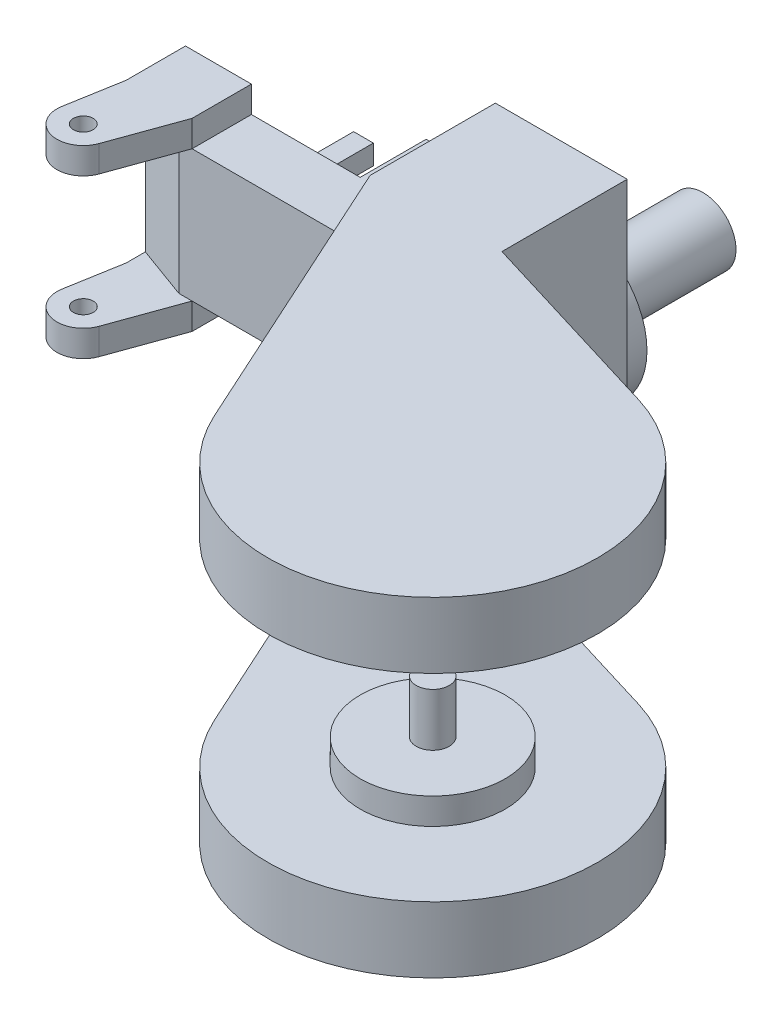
SolidWorks part; units mm, degrees
ref_plane "Front" through (0, 0, 0) normal (0, 0, 1) x (1, 0, 0)
ref_plane "Top" through (0, 0, 0) normal (0, 1, 0) x (1, 0, 0)
ref_plane "Right" through (0, 0, 0) normal (1, 0, 0) x (0, 0, -1)
imported_body "Imported"
other "Move Face1"
other "Move Face2"
